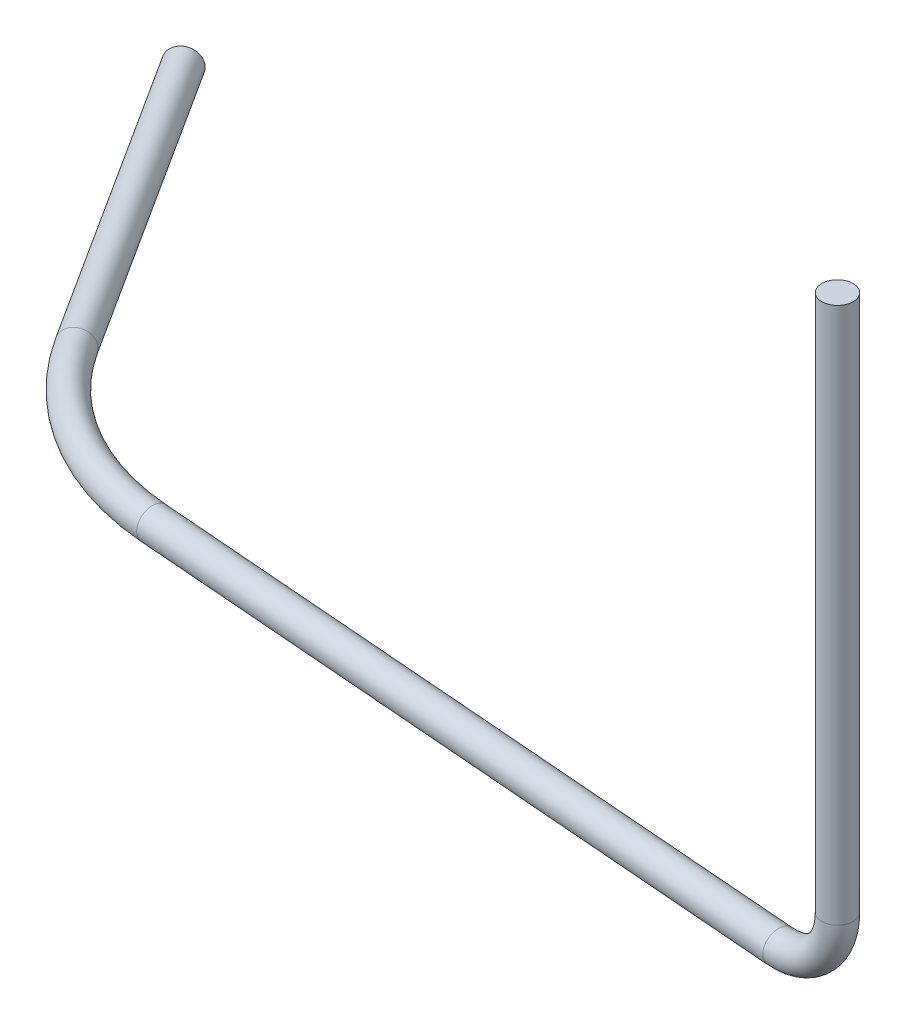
SolidWorks part; units mm, degrees
ref_plane "Plan de face" through (0, 0, 0) normal (0, 0, 1) x (1, 0, 0)
ref_plane "Plan de dessus" through (0, 0, 0) normal (0, 1, 0) x (1, 0, 0)
ref_plane "Plan de droite" through (0, 0, 0) normal (1, 0, 0) x (0, 0, -1)
sketch3d "Esquisse3D2"
  line L0 (3.9642, 6, 8.4353) -> (3.9642, -2.54, 8.4353)
  line L1 (2.9673, -3.54, 8.3573) -> (-7.8409, -3.54, 7.5109)
  line L2 (-10.8977, -3.54, 5.6795) -> (-13.9229, -3.54, 0.9529)
  arc A0 (3.9642, -2.54, 8.4353) -> (2.9673, -3.54, 8.3573) centre (2.9673, -2.54, 8.3573) ccw
  arc A1 (-7.8409, -3.54, 7.5109) -> (-10.8977, -3.54, 5.6795) centre (-7.5287, -3.54, 3.5232) ccw
  point P6 (3.9642, -3.54, 8.4353)
  point P7 (-10.0166, 2.6506, 6.787)
  point P9 (3.0453, -2.54, 7.3603)
  point P11 (3.9642, 2.6506, 8.4353)
  point P13 (-9.8249, -3.54, 7.3556)
  point P14 (-7.5287, -7.54, 3.5232)
  dimension "D1" = 1
  dimension "D2" = 4
ref_plane "Plan1" through (3.9642, 6, 8.4353) normal (0, -1, 0) x (1, 0, 0)
sketch "Esquisse1" plane through (3.9642, 6, 8.4353) normal (0, -1, 0) x (1, 0, 0)
  circle A0 centre (0, 0) radius 0.25
sweep "Balayage1" add profiles "Esquisse1" path "Esquisse3D2"
